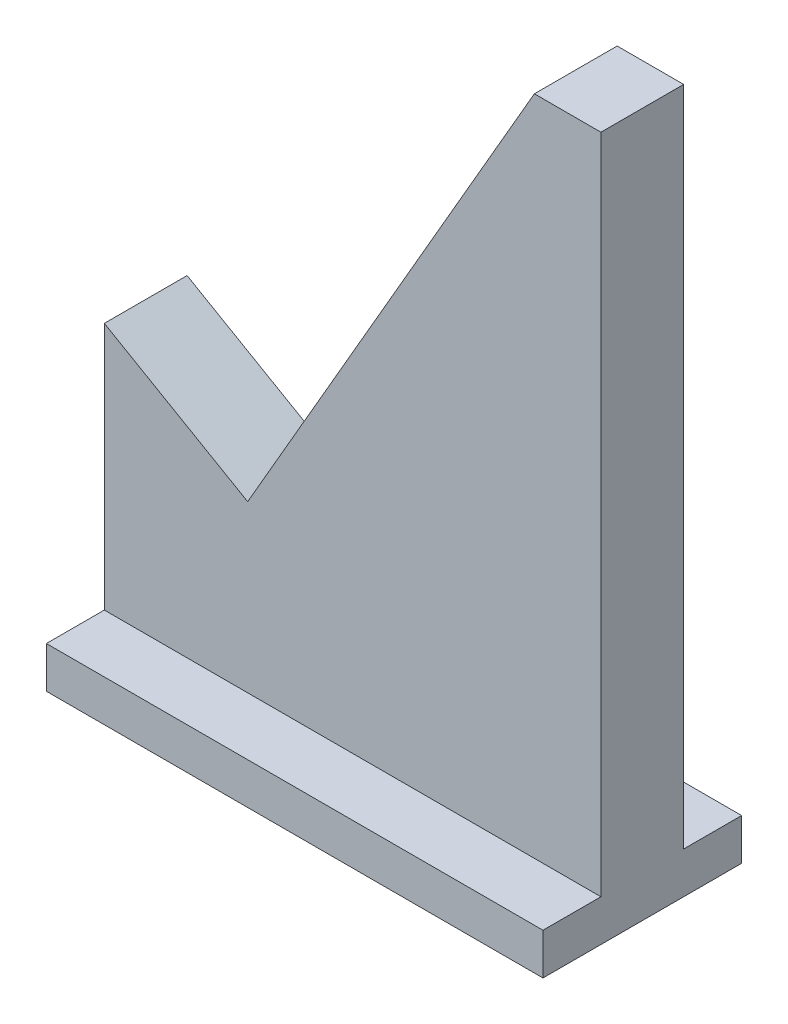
SolidWorks part; units mm, degrees
ref_plane "Face" through (0, 0, 0) normal (0, 0, 1) x (1, 0, 0)
ref_plane "Dessus" through (0, 0, 0) normal (0, 1, 0) x (1, 0, 0)
ref_plane "Droite" through (0, 0, 0) normal (1, 0, 0) x (0, 0, -1)
sketch "Esquisse1" plane through (0, 0, 0) normal (0, 0, 1) x (1, 0, 0)
  line L1 (-8.0385, 80) -> (0, 80)
  line L2 (-8.0385, 80) -> (-42.6795, 20)
  line L3 (-60, 0) -> (0, 0)
  line L4 (0, 80) -> (0, 0)
  line L7 (-42.6795, 20) -> (-60, 30)
  line L8 (-60, 0) -> (-60, 30)
  dimension "D1" = 90
  dimension "D2" = 60
  dimension "D3" = 80
  dimension "D4" = 20
  dimension "D5" = 30
  dimension "D6" = 60
extrude "Extrusion1" add sketch "Esquisse1" along normal mid plane 10
sketch "Esquisse2" plane through (0, 0, 0) normal (0, 0, 1) x (1, 0, 0)
  line L1 (-60, 0) -> (0, 0)
  line L2 (-60, 0) -> (-60, -5)
  line L3 (-60, -5) -> (0, -5)
  line L4 (0, 0) -> (0, -5)
  dimension "D1" = 5
extrude "Extrusion2" add sketch "Esquisse2" along normal mid plane 24
